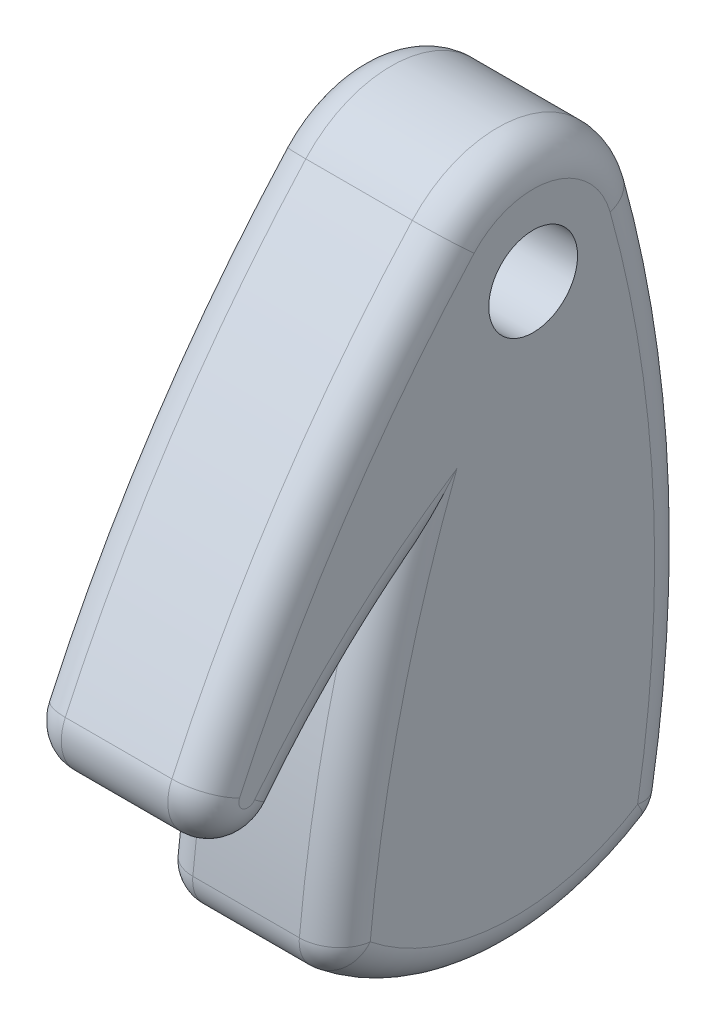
SolidWorks part; units mm, degrees
ref_plane "XY" through (0, 0, 0) normal (0, 0, 1) x (1, 0, 0)
ref_plane "YZ" through (0, 0, 0) normal (0, 1, 0) x (1, 0, 0)
ref_plane "XZ" through (0, 0, 0) normal (1, 0, 0) x (0, 0, -1)
ref_plane "Arm-plane" through (254, 0, 0) normal (1, 0, 0) x (0, 0, -1)
sketch "Sketch10" plane through (254, 0, 0) normal (1, 0, 0) x (0, 0, -1)
  line L0 (14.6537, -451.8825) -> (20.081, -363.1483) construction
  line L1 (0, 432.2232) -> (0, -432.2232) construction
  arc A0 (51.8841, -354.2667) -> (-4.3391, -340.9226) centre (20.081, -363.1483) ccw
  arc A1 (-4.3391, -340.9226) -> (-73.1292, -444.9241) centre (296.2149, -614.4701) ccw
  arc A2 (51.8841, -354.2667) -> (59.2236, -513.6883) centre (-290.611, -449.9144) cw
  arc A3 (59.2236, -513.6883) -> (-37.1164, -507.7958) centre (14.6537, -451.8825) cw
  arc A4 (-37.1164, -507.7958) -> (-21.9767, -426.6904) centre (367.8893, -541.4311) cw
  arc A5 (-73.1292, -444.9241) -> (-51.5724, -458.0323) centre (-61.5872, -450.2224) ccw
  arc A6 (-51.5724, -458.0323) -> (-21.9767, -426.6904) centre (128.6934, -598.6104) cw
  dimension "D1" = 33.02
  dimension "D2" = 355.6
  dimension "D3" = 165.1
  dimension "D6" = 406.4
  dimension "D8" = 12.7
  dimension "D9" = 228.6
  dimension "D11" = 406.4
  dimension "D4" = 76.2
  dimension "D5" = 3.5
  dimension "D7" = 119.38
  dimension "D10" = 76.2
  dimension "D12" = 48.26
  dimension "D13" = 48.26
  dimension "D14" = 76.2
  dimension "D15" = 38.1
extrude "Base-Extrude" add sketch "Sketch10" along normal mid plane 50.8
fillet "Fillet1" radius 10.16
fillet "Fillet2" radius 10.16
sketch "Sketch11" plane through (228.6, 0, 0) normal (-1, 0, 0) x (0, 0, 1)
  circle A0 centre (-20.081, -363.1483) radius 12.7
  arc A1 (-3.1748, -347.7613) -> (-42.0985, -356.9995) centre (-20.081, -363.1483) ccw construction
  dimension "D1" = 25.4
extrude "Cut-Extrude1" cut sketch "Sketch11" against normal through all
